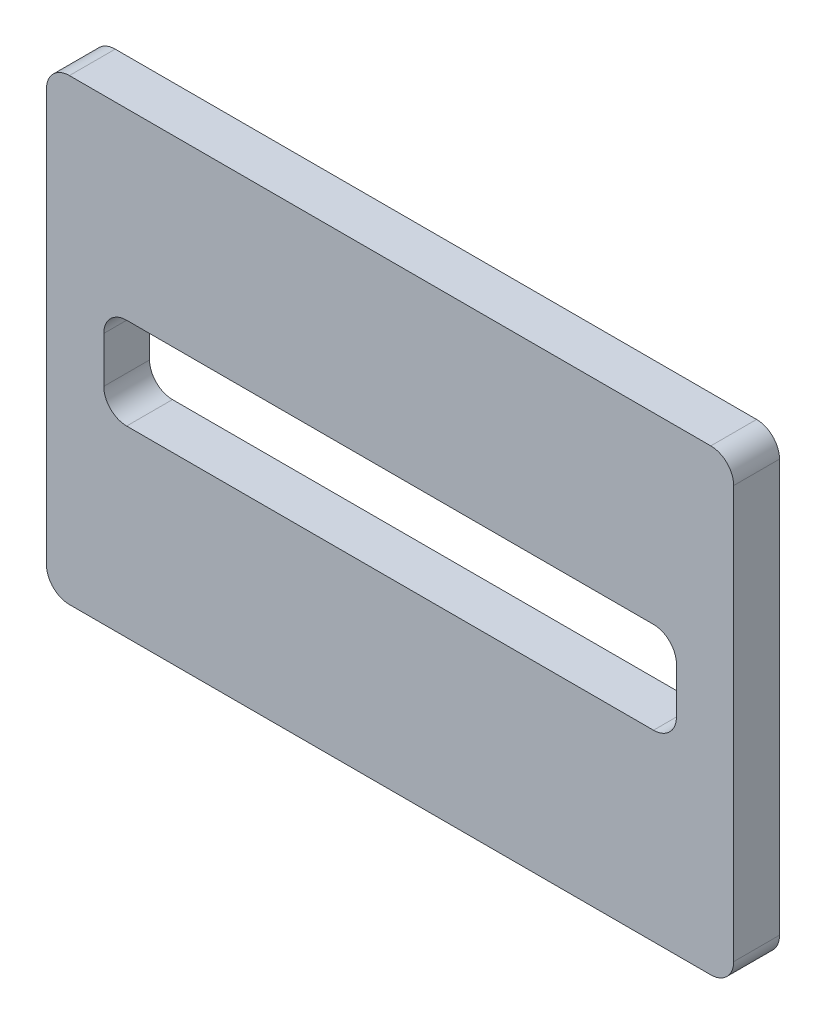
SolidWorks part; units mm, degrees
ref_plane "Plan de face" through (0, 0, 0) normal (0, 0, 1) x (1, 0, 0)
ref_plane "Plan de dessus" through (0, 0, 0) normal (0, 1, 0) x (1, 0, 0)
ref_plane "Plan de droite" through (0, 0, 0) normal (1, 0, 0) x (0, 0, -1)
sketch "Esquisse2" plane through (0, 0, 0) normal (0, 0, 1) x (1, 0, 0)
  line L1 (0, 0) -> (300, 0)
  line L2 (0, 0) -> (0, 200)
  line L3 (0, 200) -> (300, 200)
  line L4 (300, 0) -> (300, 200)
  dimension "D1" = 300
  dimension "D2" = 200
extrude "Boss.-Extru.1" add sketch "Esquisse2" along normal blind 20
sketch "Esquisse6" plane through (0, 0, 0) normal (0, 0, -1) x (-1, 0, 0)
  line L0 (0, 0) -> (-300, 0) construction
  line L1 (-25, 30) -> (-275, 30)
  line L2 (-25, 30) -> (-25, 41)
  line L3 (-25, 41) -> (-275, 41)
  line L4 (-275, 30) -> (-275, 41)
  line L5 (0, 200) -> (0, 0) construction
  line L6 (-300, 200) -> (0, 200) construction
  line L7 (-25, 170) -> (-275, 170)
  line L8 (-25, 170) -> (-25, 159)
  line L9 (-25, 159) -> (-275, 159)
  line L10 (-275, 170) -> (-275, 159)
  line L11 (-300, 0) -> (-300, 200) construction
  dimension "D1" = 30
  dimension "D2" = 11
  dimension "D3" = 250
  dimension "D4" = 25
  dimension "D5" = 250
  dimension "D6" = 11
  dimension "D7" = 30
  dimension "D8" = 25
extrude "Enlèv. mat.-Extru.2" cut sketch "Esquisse6" against normal blind 3
fillet "Congé1" radius 10 4 edges at (300, 0, 10) (300, 200, 10) (0, 200, 10) (0, 0, 10)
sketch "Esquisse7" plane through (0, 0, 0) normal (0, 0, -1) x (-1, 0, 0)
  line L1 (-25, 120) -> (-275, 120)
  line L2 (-25, 120) -> (-25, 80)
  line L3 (-25, 80) -> (-275, 80)
  line L4 (-275, 120) -> (-275, 80)
  line L5 (-290, 200) -> (-10, 200) construction
  line L6 (-300, 10) -> (-300, 190) construction
  dimension "D1" = 250
  dimension "D2" = 40
  dimension "D3" = 80
  dimension "D4" = 25
extrude "Enlèv. mat.-Extru.3" cut sketch "Esquisse7" against normal through all
fillet "Congé3" radius 10 4 edges at (25, 80, 10) (25, 120, 10) (275, 80, 10) (275, 120, 10)
